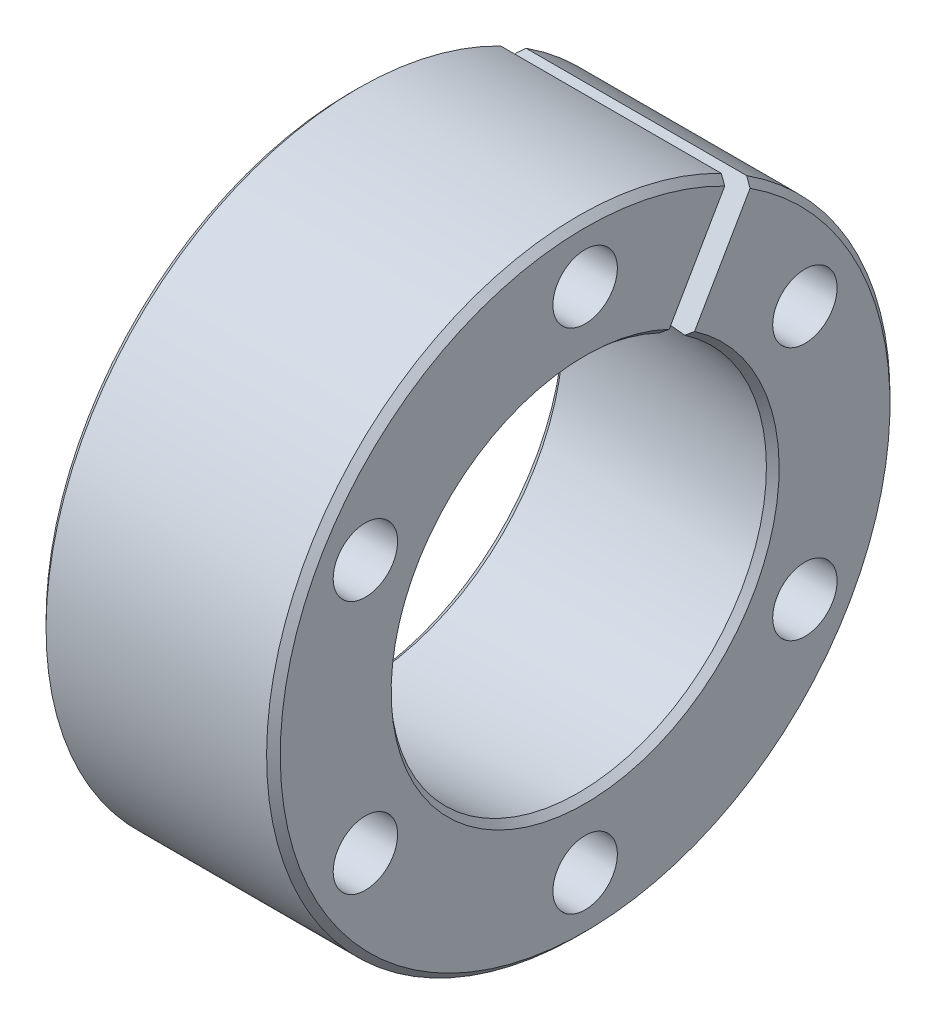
SolidWorks part; units mm, degrees
ref_plane "前视基准面" through (0, 0, 0) normal (0, 0, 1) x (1, 0, 0)
ref_plane "上视基准面" through (0, 0, 0) normal (0, 1, 0) x (1, 0, 0)
ref_plane "右视基准面" through (0, 0, 0) normal (1, 0, 0) x (0, 0, -1)
other "Configuration Table"
sketch "草图1" plane through (0, 0, 0) normal (0, 0, 1) x (1, 0, 0)
  line L0 (0, 0) -> (13.4442, 0) construction
  line L1 (0, 15.97) -> (12, 15.97)
  line L2 (12, 15.97) -> (12, 9.6123)
  line L3 (12, 9.6123) -> (0, 10.4725)
  line L4 (0, 10.4725) -> (0, 15.97)
  line L5 (0, 10.4725) -> (-3, 10.6875) construction
  line L6 (-3, 10.6875) -> (-3, 0) construction
  line L7 (-3, 0) -> (0, 0) construction
  line L8 (0, 0) -> (0, 10.4725) construction
  dimension "D1" = 31.94
  dimension "D2" = 4.1
  dimension "D3" = 12
  dimension "D4" = 21.375
  dimension "D5" = 3
revolve "旋转1" add sketch "草图1" angle 360 about L0
chamfer "倒角1" distance 0.35 angle 45 3 edges at (0, 0, 15.97) (12, 0, 9.6123) (12, 0, 15.97)
hole_wizard " 螺纹孔1" positions "草图2" profile "草图3" tap size "M4" standard "GB"
sketch "草图2" plane through (0, 0, 0) normal (-1, 0, 0) x (0, 0, 1)
  point P0 (0, 13)
  dimension "外径" = 13
sketch "草图3" plane through (0, 13, 0) normal (0, 1, 0) x (0, 0, 1)
  line L0 (0, 0) -> (0, 12)
  line L1 (0, 12) -> (1.65, 12)
  line L2 (1.65, 12) -> (1.65, 0)
  line L5 (1.65, 0) -> (0, 0)
  line L11 (0, -6.35) -> (0, 107.95) construction
  dimension "通孔螺纹孔钻头直径" = 3.3
  dimension "通孔螺纹孔钻头深度" = 12
pattern_circular "阵列(圆周)1" count 6 over 360 about axis through (0, 0, 0) along (1, 0, 0) of " 螺纹孔1"
sketch "草图4" plane through (0, 0, 0) normal (-1, 0, 0) x (0, 0, 1)
  line L0 (0, 0) -> (-7.985, 13.8304)
  line L1 (0, 13) -> (0, 0) construction
  circle A0 centre (0, 0) radius 15.97 construction
  dimension "D1" = 30
extrude "切除-拉伸-薄壁1" cut sketch "草图4" against normal through all and the other way through all thin
chamfer "倒角2" distance 0.4 angle 45 1 edges at (0, -9.0694, 5.2362)
